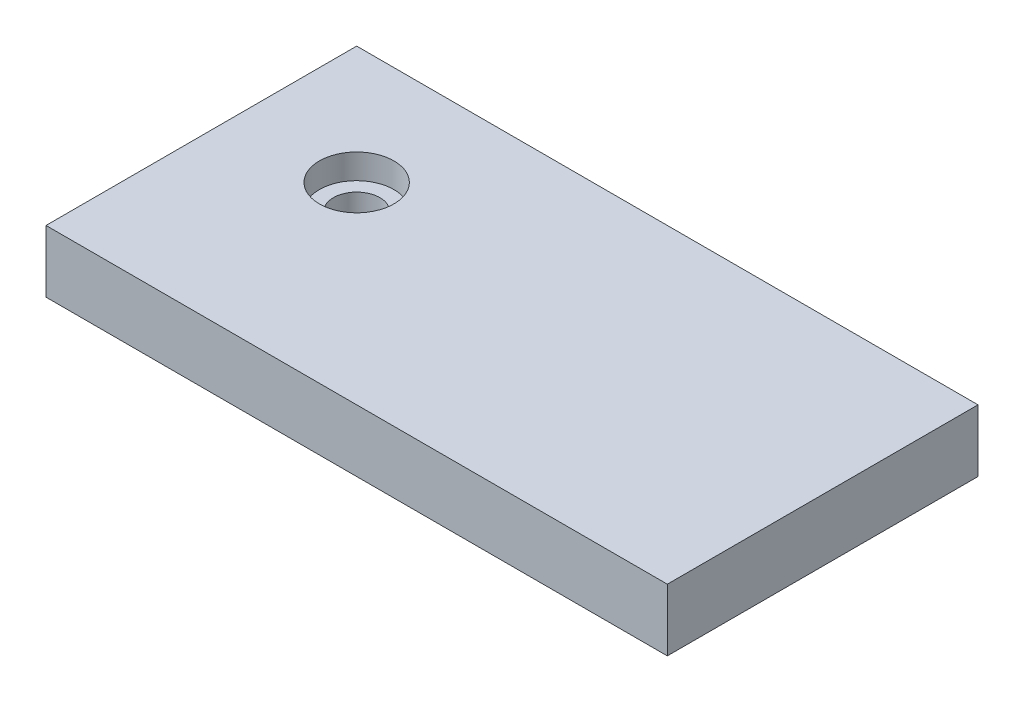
SolidWorks part; units mm, degrees
ref_plane "Front Plane" through (0, 0, 0) normal (0, 0, 1) x (1, 0, 0)
ref_plane "Top Plane" through (0, 0, 0) normal (0, 1, 0) x (1, 0, 0)
ref_plane "Right Plane" through (0, 0, 0) normal (1, 0, 0) x (0, 0, -1)
sketch "Sketch1" plane through (0, 0, 0) normal (0, 1, 0) x (1, 0, 0)
  line L1 (0, 0) -> (100, 0)
  line L2 (0, 0) -> (0, 50)
  line L3 (0, 50) -> (100, 50)
  line L4 (100, 0) -> (100, 50)
  dimension "D1" = 100
  dimension "D2" = 50
extrude "Extrude1" add sketch "Sketch1" along normal blind 10
hole_wizard "CBORE for M3 SBHCS1" positions "3DSketch1" profile "Sketch2" counterbore size "M3" standard "ANSI Metric"
sketch3d "3DSketch1"
  line L0 (0, 10, -50) -> (0, 10, 0) construction
  line L1 (100, 10, -50) -> (0, 10, -50) construction
  point P0 (19, 10, -31)
  dimension "D1" = 19
  dimension "D2" = 19
sketch "Sketch2" plane through (19, 10, -31) normal (1, 0, 0) x (0, 0, 1)
  line L0 (0, 0) -> (0, 10)
  line L1 (0, 10) -> (3.75, 10)
  line L3 (3.75, 10) -> (3.75, 4)
  line L4 (3.75, 4) -> (6, 4)
  line L5 (6, 4) -> (6, 0)
  line L7 (6, 0) -> (0, 0)
  line L11 (0, -6.35) -> (0, 107.95) construction
  dimension "Thru Hole Dia." = 7.5
  dimension "Thru Hole Depth" = 10
  dimension "C'Bore Dia." = 12
  dimension "C'Bore Depth" = 4
